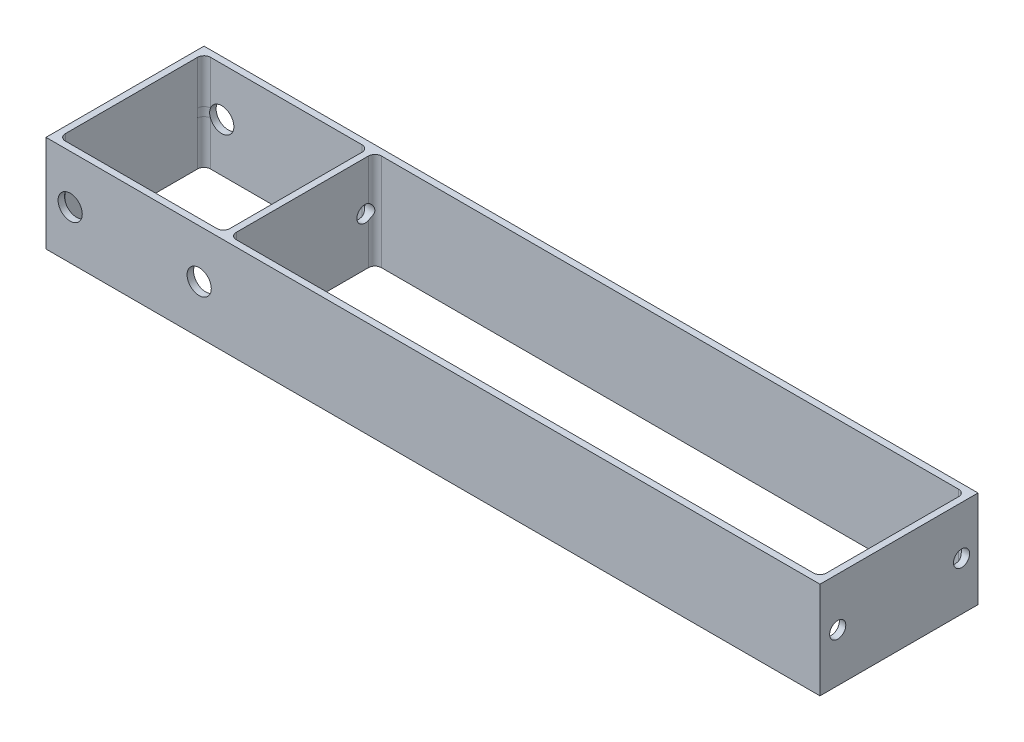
SolidWorks part; units mm, degrees
ref_plane "Front Plane" through (0, 0, 0) normal (0, 0, 1) x (1, 0, 0)
ref_plane "Top Plane" through (0, 0, 0) normal (0, 1, 0) x (1, 0, 0)
ref_plane "Right Plane" through (0, 0, 0) normal (1, 0, 0) x (0, 0, -1)
sketch "Sketch1" plane through (0, 0, 0) normal (0, 0, 1) x (1, 0, 0)
  line L1 (-67.377, 65.0154) -> (542.223, 65.0154)
  line L2 (-67.377, 65.0154) -> (-67.377, -11.1846)
  line L3 (-67.377, -11.1846) -> (542.223, -11.1846)
  line L4 (542.223, 65.0154) -> (542.223, -11.1846)
  dimension "D1" = 609.6
  dimension "D2" = 76.2
extrude "Extrude1" add sketch "Sketch1" along normal blind 124.46
sketch "Sketch4" plane through (0, 65.0154, 0) normal (0, 1, 0) x (-1, 0, 0)
  line L4 (-542.223, 124.46) -> (-542.223, 0) construction
  line L5 (-67.243, 5.08) -> (62.297, 5.08)
  line L6 (-72.323, 119.38) -> (-72.323, 5.08)
  line L8 (-537.143, 5.08) -> (62.297, 5.08)
  line L9 (62.297, 5.08) -> (62.297, 119.38)
  line L10 (62.297, 119.38) -> (-537.143, 119.38)
  line L11 (-537.143, 119.38) -> (-537.143, 5.08)
  line L12 (-537.143, 5.08) -> (-72.323, 5.08)
  line L13 (62.297, 5.08) -> (62.297, 119.38)
  line L14 (62.297, 119.38) -> (-67.243, 119.38)
  line L15 (-537.143, 119.38) -> (-537.143, 5.08)
  line L16 (-67.243, 119.38) -> (-67.243, 5.08)
  line L17 (-72.323, 119.38) -> (-537.143, 119.38)
  dimension "D2" = 5.08
  dimension "D3" = 469.9
  dimension "D1" = 5.08
extrude "Cut-Extrude1" cut sketch "Sketch4" against normal through all
sketch "Sketch5" plane through (0, 0, 124.46) normal (0, 0, 1) x (1, 0, 0)
  line L0 (542.223, 65.0154) -> (-67.377, 65.0154) construction
  line L1 (-67.377, 65.0154) -> (-67.377, -11.1846) construction
  circle A0 centre (-48.327, 26.9154) radius 9.525
  circle A1 centre (53.273, 26.9154) radius 9.525
  dimension "D1" = 38.1
  dimension "D2" = 38.1
  dimension "D3" = 19.05
  dimension "D4" = 101.6
extrude "Cut-Extrude2" cut sketch "Sketch5" against normal through all
fillet "Fillet1" radius 5.08 6 edges at (67.243, 26.9154, 5.08) (537.143, 26.9154, 5.08) (-62.297, 26.9154, 5.08) (72.323, 26.9154, 5.08) (537.143, 26.9154, 119.38) (67.243, 26.9154, 119.38)
fillet "Fillet2" radius 5.08 1 edges at (72.323, 26.9154, 119.38)
fillet "Fillet3" radius 5.08 1 edges at (-62.297, 26.9154, 119.38)
sketch "Sketch6" plane through (542.223, 0, 0) normal (1, 0, 0) x (0, 0, -1)
  line L0 (-124.46, -11.1846) -> (0, -11.1846) construction
  line L1 (-124.46, -11.1846) -> (-124.46, 65.0154) construction
  circle A0 centre (-110.49, 26.9154) radius 6.35
  circle A1 centre (-12.954, 26.9154) radius 6.35
  dimension "D1" = 12.7
  dimension "D2" = 38.1
  dimension "D3" = 38.1
  dimension "D4" = 97.536
  dimension "D5" = 13.97
extrude "Cut-Extrude3" cut sketch "Sketch6" against normal blind 508
